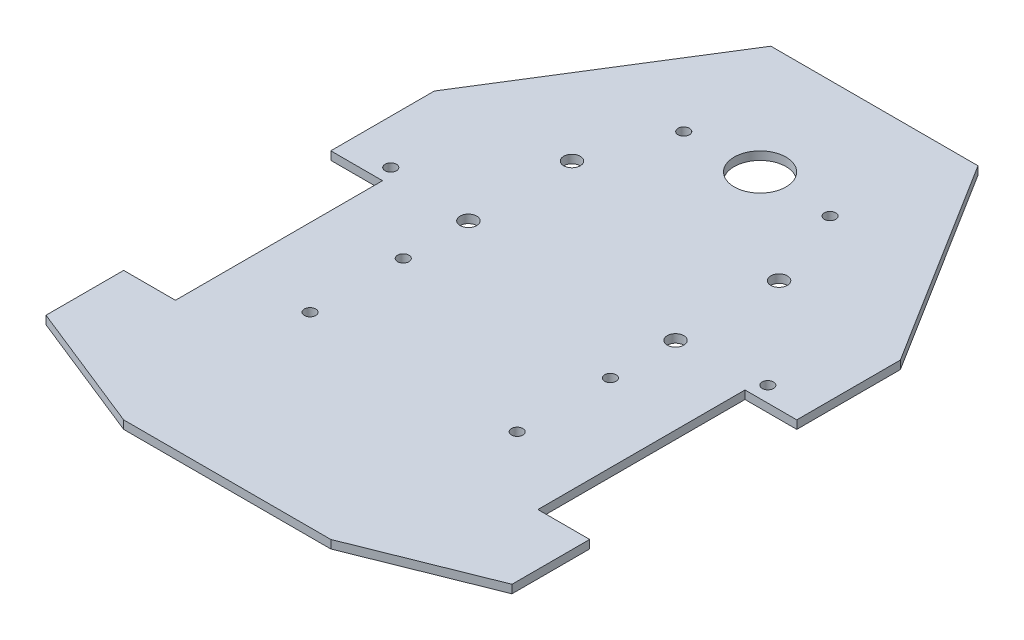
SolidWorks part; units mm, degrees
ref_plane "Front Plane" through (0, 0, 0) normal (0, 0, 1) x (1, 0, 0)
ref_plane "Top Plane" through (0, 0, 0) normal (0, 1, 0) x (1, 0, 0)
ref_plane "Right Plane" through (0, 0, 0) normal (1, 0, 0) x (0, 0, -1)
sketch "Sketch1" plane through (0, 0, 0) normal (0, 1, 0) x (1, 0, 0)
  line L0 (0, -60) -> (0, 65) construction
  line L1 (-20, 65) -> (20, 65)
  line L3 (-20, -60) -> (20, -60)
  line L4 (45, 25) -> (45, 5)
  line L5 (15, -60) -> (15.4545, -61.8182) construction
  line L7 (20, -60) -> (45, -50)
  line L8 (45, -35) -> (35, -35)
  line L9 (35, -35) -> (35, 5)
  line L10 (35, 5) -> (45, 5)
  line L11 (45, 25) -> (20, 65)
  line L12 (-45, 25) -> (-20, 65)
  line L13 (-35, 5) -> (-45, 5)
  line L14 (-35, -35) -> (-35, 5)
  line L15 (-45, -35) -> (-35, -35)
  line L16 (-20, -60) -> (-45, -50)
  line L17 (45, -35) -> (45, -50)
  line L18 (-45, 25) -> (-45, 5)
  line L19 (-45, -35) -> (-45, -50)
  circle A0 centre (0, 42.9149) radius 5
  point P0 (0, 0)
  dimension "D8" = 10
  dimension "D1" = 20
  dimension "D2" = 10
  dimension "D3" = 40
  dimension "D4" = 20
  dimension "D5" = 40
  dimension "D6" = 15
  dimension "D7" = 20
extrude "Boss-Extrude1" add sketch "Sketch1" along normal blind 1.6
sketch "Sketch2" plane through (0, 1.6, 0) normal (0, 1, 0) x (1, 0, 0)
  line L0 (-35, -15) -> (35, -15) construction
  line L1 (-35, 5) -> (-35, -35) construction
  line L2 (35, -35) -> (35, 5) construction
  line L3 (0, 0) -> (0, -60) construction
  line L4 (-20, -60) -> (20, -60) construction
  circle A0 centre (-20, -6) radius 1.1
  circle A1 centre (-20, -24) radius 1.1
  circle A2 centre (20, -24) radius 1.1
  circle A3 centre (20, -6) radius 1.1
  dimension "D1" = 2.2
  dimension "D2" = 15
  dimension "D3" = 9
extrude "Cut-Extrude1" cut sketch "Sketch2" against normal through all
sketch "Sketch3" plane through (0, 1.6, 0) normal (0, 1, 0) x (1, 0, 0)
  line L0 (0, 32.0819) -> (0, 1.0819) construction
  line L1 (23, 32.0819) -> (-23, 32.0819) construction
  line L2 (-23, 1.0819) -> (23, 1.0819) construction
  line L3 (-25, 16.5819) -> (25, 16.5819) construction
  line L4 (-25, 0.0819) -> (-25, 33.0819) construction
  line L5 (25, 33.0819) -> (25, 0.0819) construction
  circle A0 centre (-20, 26.5819) radius 1.6
  circle A1 centre (20, 26.5819) radius 1.6
  circle A2 centre (20, 6.5819) radius 1.6
  circle A3 centre (-20, 6.5819) radius 1.6
  dimension "D1" = 3.2
  dimension "D2" = 20
  dimension "D3" = 10
extrude "Cut-Extrude2" cut sketch "Sketch3" against normal up to next
sketch "Sketch5" plane through (0, 1.6, 0) normal (0, 1, 0) x (1, 0, 0)
  line L0 (0, 65) -> (0, 0) construction
  line L1 (20, 65) -> (-20, 65) construction
  line L2 (-41.5, 11) -> (-30.5, 11) construction
  line L3 (-18.5315, 37.779) -> (-15.5384, 48.364) construction
  circle A0 centre (-36.4123, 8) radius 1.1
  circle A2 centre (36.4123, 8) radius 1.1
  circle A3 centre (-14.1349, 42.302) radius 1.1
  circle A4 centre (14.1349, 42.302) radius 1.1
  dimension "D1" = 2.2
  dimension "D2" = 3
  dimension "D3" = 2.2
  dimension "D4" = 3
extrude "Cut-Extrude3" cut sketch "Sketch5" against normal up to next
